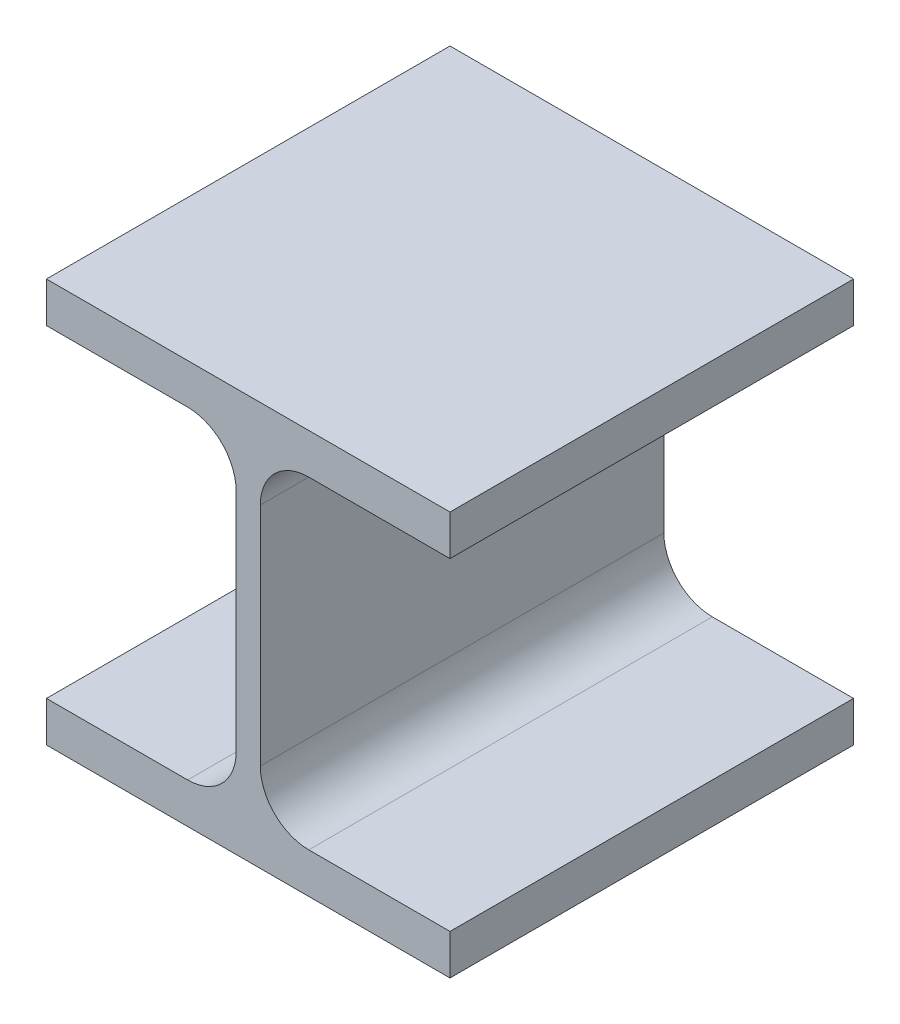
SolidWorks part; units mm, degrees
ref_plane "Ebene1" through (0, 0, 0) normal (0, 0, 1) x (1, 0, 0)
ref_plane "Ebene2" through (0, 0, 0) normal (0, 1, 0) x (1, 0, 0)
ref_plane "Ebene3" through (0, 0, 0) normal (1, 0, 0) x (0, 0, -1)
extrude "Basis-Linear austragen" add sketch "Skizze1" against normal blind 100
sketch "Skizze1" plane through (0, 0, 0) normal (0, 0, 1) x (1, 0, 0)
  line L0 (0, 100) -> (0, -90) construction
  line L1 (-50, 0) -> (50, 0)
  line L2 (50, 0) -> (50, 10)
  line L3 (-50, 0) -> (-50, 10)
  line L4 (50, 10) -> (15, 10)
  line L5 (-50, 10) -> (-15, 10)
  line L6 (3, 22) -> (3, 78)
  line L7 (-3, 22) -> (-3, 78)
  line L8 (15, 90) -> (50, 90)
  line L9 (-15, 90) -> (-50, 90)
  line L10 (50, 90) -> (50, 100)
  line L11 (-50, 90) -> (-50, 100)
  line L12 (50, 100) -> (-50, 100)
  arc A0 (15, 90) -> (3, 78) centre (15, 78) ccw
  arc A1 (-3, 78) -> (-15, 90) centre (-15, 78) ccw
  arc A2 (15, 10) -> (3, 22) centre (15, 22) cw
  arc A3 (-15, 10) -> (-3, 22) centre (-15, 22) ccw
  point P6 (0, 0)
  point P16 (0, 100)
  dimension "D5" = 12
  dimension "D6" = 12
  dimension "r1" = 12
  dimension "D8" = 12
  dimension "h" = 100
  dimension "b" = 100
  dimension "t" = 10
  dimension "s" = 6
